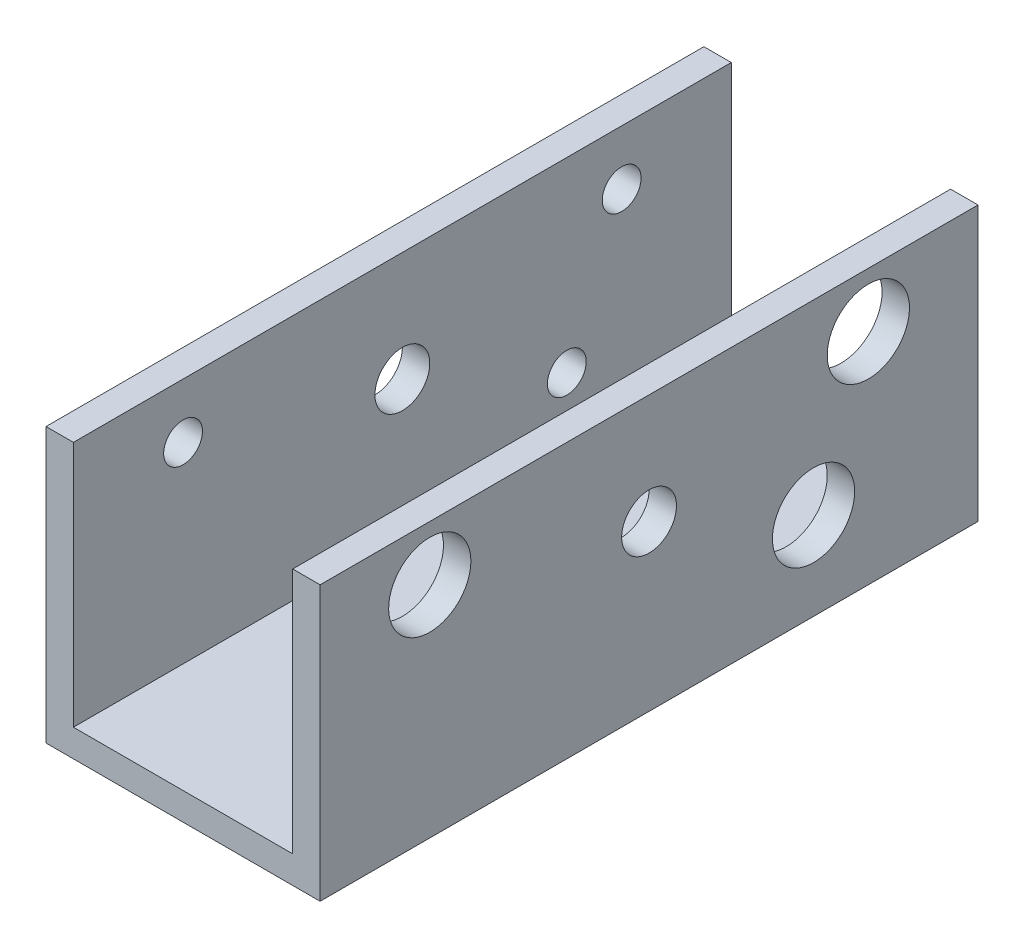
SolidWorks part; units mm, degrees
ref_plane "Front Plane" through (0, 0, 0) normal (0, 0, 1) x (1, 0, 0)
ref_plane "Top Plane" through (0, 0, 0) normal (0, 1, 0) x (1, 0, 0)
ref_plane "Right Plane" through (0, 0, 0) normal (1, 0, 0) x (0, 0, -1)
sketch "Sketch1" plane through (0, 0, 0) normal (0, 0, 1) x (1, 0, 0)
  line L0 (0, 0) -> (0, 31.75)
  line L1 (0, 31.75) -> (3.175, 31.75)
  line L2 (3.175, 31.75) -> (3.175, 3.175)
  line L3 (3.175, 3.175) -> (28.575, 3.175)
  line L4 (28.575, 3.175) -> (28.575, 31.75)
  line L5 (28.575, 31.75) -> (31.75, 31.75)
  line L6 (31.75, 31.75) -> (31.75, 0)
  line L7 (31.75, 0) -> (0, 0)
  dimension "D1" = 3.175
  dimension "D2" = 3.175
  dimension "D3" = 31.75
  dimension "D4" = 31.75
extrude "Boss-Extrude1" add sketch "Sketch1" along normal blind 76.2
sketch "Sketch2" plane through (31.75, 0, 0) normal (1, 0, 0) x (0, 0, -1)
  line L0 (0, 0) -> (0, 31.75) construction
  line L1 (-76.2, 0) -> (-76.2, 31.75) construction
  line L2 (-76.2, 31.75) -> (0, 31.75) construction
  circle A0 centre (-38.1, 19.05) radius 3.175
  circle A1 centre (-63.5, 25.4) radius 4.7625
  circle A2 centre (-12.7, 25.4) radius 4.7625
  circle A3 centre (-19.05, 10.16) radius 4.7625
  dimension "D1" = 6.35
  dimension "D2" = 9.525
  dimension "D3" = 38.1
  dimension "D4" = 12.7
  dimension "D5" = 12.7
  dimension "D6" = 6.35
  dimension "D7" = 12.7
  dimension "D8" = 21.59
  dimension "D9" = 19.05
extrude "Cut-Extrude1" cut sketch "Sketch2" against normal up to next
sketch "Sketch3" plane through (3.175, 0, 0) normal (1, 0, 0) x (0, 0, -1)
  line L0 (-76.2, 0) -> (0, 0) construction
  circle A0 centre (-63.5, 25.4) radius 4.7625 construction
  circle A1 centre (-63.5, 25.4) radius 4.7625
  circle A2 centre (-12.7, 25.4) radius 4.7625 construction
  circle A3 centre (-12.7, 25.4) radius 4.7625
  circle A4 centre (-19.05, 10.16) radius 4.7625 construction
  circle A5 centre (-19.05, 10.16) radius 4.7625
  circle A6 centre (-38.1, 19.05) radius 3.175 construction
  circle A7 centre (-38.1, 19.05) radius 3.175
  dimension "D1" = 19.05
extrude "Cut-Extrude2" cut sketch "Sketch3" against normal through all contours A7
hole_wizard "#8 Clearance Hole1" positions "Sketch7" profile "Sketch8" hole size "#8" standard "ANSI Inch"
sketch "Sketch7" plane through (3.175, 0, 0) normal (1, 0, 0) x (0, 0, -1)
  point P0 (-12.7, 25.4)
  point P3 (-19.05, 10.16)
  point P6 (-63.5, 25.4)
sketch "Sketch8" plane through (3.175, 25.4, 12.7) normal (0, 1, 0) x (0, 0, -1)
  line L0 (0, 0) -> (0, 33.1007)
  line L1 (0, 33.1007) -> (2.2479, 31.75)
  line L2 (2.2479, 31.75) -> (2.2479, 0)
  line L5 (2.2479, 0) -> (0, 0)
  line L10 (0, 33.1007) -> (-2.2479, 31.75) construction
  line L11 (0, -6.35) -> (0, 107.95) construction
  dimension "Hole Dia." = 4.4958
  dimension "Hole Depth" = 31.75
  dimension "Drill Angle" = 118
